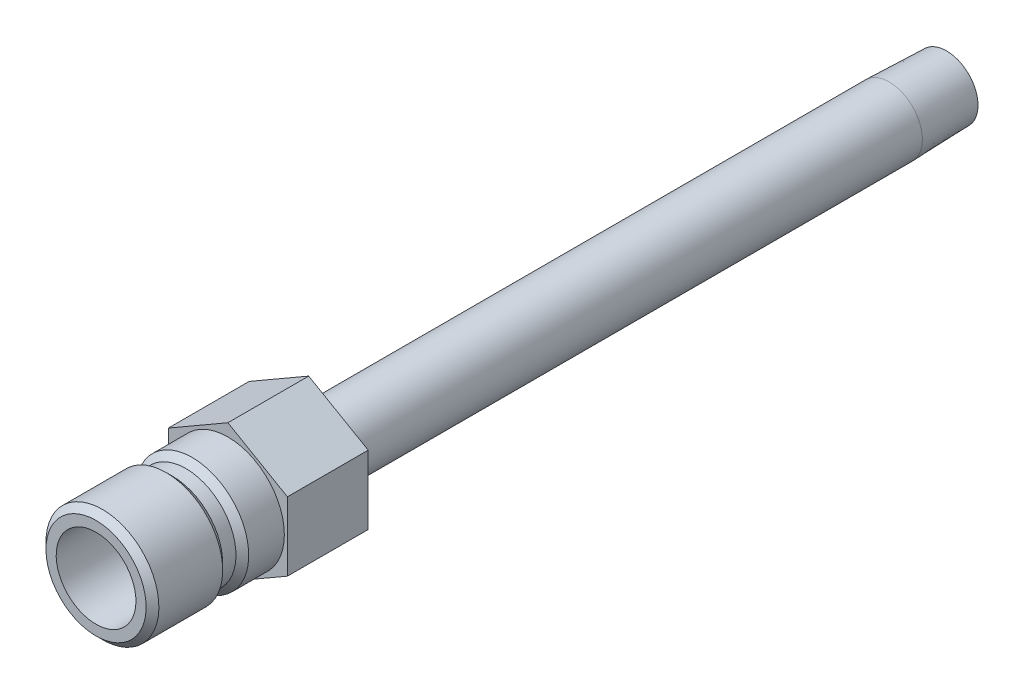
SolidWorks part; units mm, degrees
ref_plane "Front Plane" through (0, 0, 0) normal (0, 0, 1) x (1, 0, 0)
ref_plane "Top Plane" through (0, 0, 0) normal (0, 1, 0) x (1, 0, 0)
ref_plane "Right Plane" through (0, 0, 0) normal (1, 0, 0) x (0, 0, -1)
sketch "Sketch1" plane through (0, 0, 0) normal (1, 0, 0) x (0, 0, -1)
  line L0 (9.652, 0) -> (-18.923, 0) construction
  line L1 (-15.748, 4.7625) -> (-15.748, 5.9817)
  line L2 (-6.604, 5.9817) -> (-6.604, 0) construction
  line L3 (-14.986, 6.7437) -> (-7.366, 6.7437)
  line L4 (0, 6.7437) -> (0, 0) construction
  line L5 (-6.604, 5.9817) -> (-5.0165, 5.9817)
  line L6 (-4.2545, 6.7437) -> (9.652, 6.7437)
  line L7 (9.652, 6.7437) -> (9.652, 3.9688)
  line L8 (-6.604, 5.9817) -> (-7.366, 6.7437)
  line L9 (-5.0165, 5.9817) -> (-4.2545, 6.7437)
  line L10 (-15.748, 5.9817) -> (-14.986, 6.7437)
  line L11 (-3.556, 4.7625) -> (-2.4351, 2.6543)
  line L12 (9.652, 3.9688) -> (78.994, 3.9688)
  line L13 (78.994, 3.9688) -> (85.852, 3.7544)
  line L14 (85.852, 3.7544) -> (85.852, 2.6543)
  line L16 (9.652, 6.731) -> (9.652, 0) construction
  line L19 (-3.556, 4.7625) -> (-15.748, 4.7625)
  line L20 (-2.4351, 2.6543) -> (85.852, 2.6543)
  dimension "D2" = 1.5875
  dimension "D3" = 0.762
  dimension "D4" = 45
  dimension "D5" = 9.144
  dimension "D6" = 45
  dimension "D7" = 1.79
  dimension "D8" = 6.858
  dimension "D9" = 101.6
  dimension "D10" = 3.175
  dimension "D11" = 9.525
  dimension "D12" = 7.9375
  dimension "D13" = 25.4
  dimension "D14" = 13.4874
  dimension "D15" = 5.3086
  dimension "D16" = 9.652
  dimension "D17" = 118
  dimension "D18" = 12.192
revolve "Revolve1" add sketch "Sketch1" angle 360 about L0
sketch "Sketch2" plane through (0, 0, 0) normal (0, 0, 1) x (1, 0, 0)
  line L1 (-7.112, 4.1061) -> (-7.112, -4.1061)
  line L2 (-7.112, -4.1061) -> (0, -8.2122)
  line L3 (0, -8.2122) -> (7.112, -4.1061)
  line L4 (7.112, -4.1061) -> (7.112, 4.1061)
  line L5 (7.112, 4.1061) -> (0, 8.2122)
  line L6 (0, 8.2122) -> (-7.112, 4.1061)
  circle A0 centre (0, 0) radius 7.112 construction
  circle A2 centre (0, 0) radius 2.6543
  circle A3 centre (0, 0) radius 2.6543 construction
  dimension "D1" = 14.224
extrude "Boss-Extrude1" add sketch "Sketch2" against normal up to vertex (9.652 mm away)
